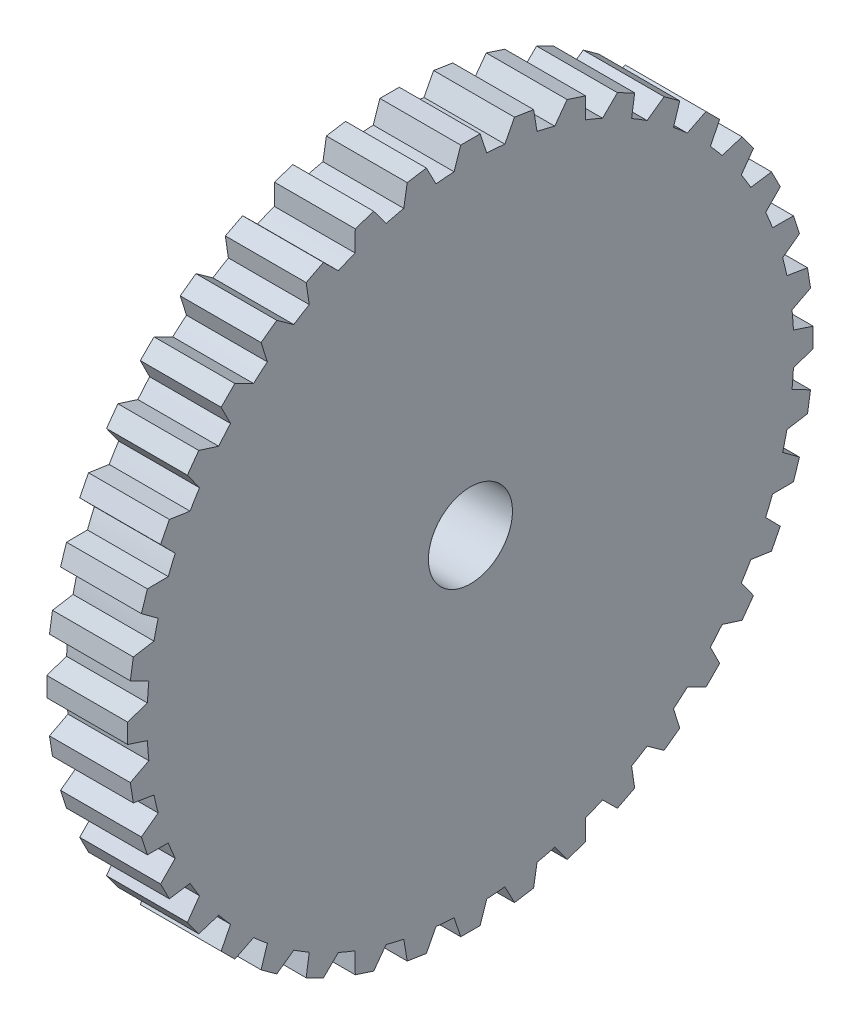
SolidWorks part; units mm, degrees
ref_plane "Front Plane" through (0, 0, 0) normal (0, 0, 1) x (1, 0, 0)
ref_plane "Top Plane" through (0, 0, 0) normal (0, 1, 0) x (1, 0, 0)
ref_plane "Right Plane" through (0, 0, 0) normal (1, 0, 0) x (0, 0, -1)
sketch "Sketch1" plane through (0, 0, 0) normal (1, 0, 0) x (0, 0, -1)
  circle A0 centre (0, 0) radius 12.7
extrude "Boss-Extrude1" add sketch "Sketch1" along normal blind 3.175
sketch "Sketch2" plane through (3.175, 0, 0) normal (1, 0, 0) x (0, 0, -1)
  line L0 (1.7296, 13.3559) -> (2.4822, 13.2367)
  line L1 (-0.762, 12.319) -> (0.762, 12.319)
  line L2 (1.7296, 13.3559) -> (1.1745, 12.2865)
  line L3 (-0.381, 13.462) -> (0.381, 13.462)
  line L4 (0.381, 13.462) -> (0.762, 12.319)
  line L5 (-0.381, 13.462) -> (-0.762, 12.319)
  line L6 (1.1745, 12.2865) -> (2.6797, 12.0481)
  line L7 (2.4822, 13.2367) -> (2.6797, 12.0481)
  line L8 (3.7976, 12.9209) -> (4.5223, 12.6854)
  line L9 (3.7976, 12.9209) -> (3.0821, 11.9515)
  line L10 (3.0821, 11.9515) -> (4.5315, 11.4806)
  line L11 (4.5223, 12.6854) -> (4.5315, 11.4806)
  line L12 (5.7721, 12.1677) -> (6.4511, 11.8218)
  line L13 (5.7721, 12.1677) -> (4.9138, 11.3223)
  line L14 (4.9138, 11.3223) -> (6.2717, 10.6304)
  line L15 (6.4511, 11.8218) -> (6.2717, 10.6304)
  line L16 (7.6045, 11.1149) -> (8.221, 10.667)
  line L17 (7.6045, 11.1149) -> (6.6245, 10.4142)
  line L18 (6.6245, 10.4142) -> (7.8574, 9.5184)
  line L19 (8.221, 10.667) -> (7.8574, 9.5184)
  line L20 (9.2497, 9.7885) -> (9.7885, 9.2497)
  line L21 (9.2497, 9.7885) -> (8.172, 9.2497)
  line L22 (8.172, 9.2497) -> (9.2497, 8.172)
  line L23 (9.7885, 9.2497) -> (9.2497, 8.172)
  line L24 (10.667, 8.221) -> (11.1149, 7.6045)
  line L25 (10.667, 8.221) -> (9.5184, 7.8574)
  line L26 (9.5184, 7.8574) -> (10.4142, 6.6245)
  line L27 (11.1149, 7.6045) -> (10.4142, 6.6245)
  line L28 (11.8218, 6.4511) -> (12.1677, 5.7721)
  line L29 (11.8218, 6.4511) -> (10.6304, 6.2717)
  line L30 (10.6304, 6.2717) -> (11.3223, 4.9138)
  line L31 (12.1677, 5.7721) -> (11.3223, 4.9138)
  line L32 (12.6854, 4.5223) -> (12.9209, 3.7976)
  line L33 (12.6854, 4.5223) -> (11.4806, 4.5315)
  line L34 (11.4806, 4.5315) -> (11.9515, 3.0821)
  line L35 (12.9209, 3.7976) -> (11.9515, 3.0821)
  line L36 (13.2367, 2.4822) -> (13.3559, 1.7296)
  line L37 (13.2367, 2.4822) -> (12.0481, 2.6797)
  line L38 (12.0481, 2.6797) -> (12.2865, 1.1745)
  line L39 (13.3559, 1.7296) -> (12.2865, 1.1745)
  line L40 (13.462, 0.381) -> (13.462, -0.381)
  line L41 (13.462, 0.381) -> (12.319, 0.762)
  line L42 (12.319, 0.762) -> (12.319, -0.762)
  line L43 (13.462, -0.381) -> (12.319, -0.762)
  line L44 (13.3559, -1.7296) -> (13.2367, -2.4822)
  line L45 (13.3559, -1.7296) -> (12.2865, -1.1745)
  line L46 (12.2865, -1.1745) -> (12.0481, -2.6797)
  line L47 (13.2367, -2.4822) -> (12.0481, -2.6797)
  line L48 (12.9209, -3.7976) -> (12.6854, -4.5223)
  line L49 (12.9209, -3.7976) -> (11.9515, -3.0821)
  line L50 (11.9515, -3.0821) -> (11.4806, -4.5315)
  line L51 (12.6854, -4.5223) -> (11.4806, -4.5315)
  line L52 (12.1677, -5.7721) -> (11.8218, -6.4511)
  line L53 (12.1677, -5.7721) -> (11.3223, -4.9138)
  line L54 (11.3223, -4.9138) -> (10.6304, -6.2717)
  line L55 (11.8218, -6.4511) -> (10.6304, -6.2717)
  line L56 (11.1149, -7.6045) -> (10.667, -8.221)
  line L57 (11.1149, -7.6045) -> (10.4142, -6.6245)
  line L58 (10.4142, -6.6245) -> (9.5184, -7.8574)
  line L59 (10.667, -8.221) -> (9.5184, -7.8574)
  line L60 (9.7885, -9.2497) -> (9.2497, -9.7885)
  line L61 (9.7885, -9.2497) -> (9.2497, -8.172)
  line L62 (9.2497, -8.172) -> (8.172, -9.2497)
  line L63 (9.2497, -9.7885) -> (8.172, -9.2497)
  line L64 (8.221, -10.667) -> (7.6045, -11.1149)
  line L65 (8.221, -10.667) -> (7.8574, -9.5184)
  line L66 (7.8574, -9.5184) -> (6.6245, -10.4142)
  line L67 (7.6045, -11.1149) -> (6.6245, -10.4142)
  line L68 (6.4511, -11.8218) -> (5.7721, -12.1677)
  line L69 (6.4511, -11.8218) -> (6.2717, -10.6304)
  line L70 (6.2717, -10.6304) -> (4.9138, -11.3223)
  line L71 (5.7721, -12.1677) -> (4.9138, -11.3223)
  line L72 (4.5223, -12.6854) -> (3.7976, -12.9209)
  line L73 (4.5223, -12.6854) -> (4.5315, -11.4806)
  line L74 (4.5315, -11.4806) -> (3.0821, -11.9515)
  line L75 (3.7976, -12.9209) -> (3.0821, -11.9515)
  line L76 (2.4822, -13.2367) -> (1.7296, -13.3559)
  line L77 (2.4822, -13.2367) -> (2.6797, -12.0481)
  line L78 (2.6797, -12.0481) -> (1.1745, -12.2865)
  line L79 (1.7296, -13.3559) -> (1.1745, -12.2865)
  line L80 (0.381, -13.462) -> (-0.381, -13.462)
  line L81 (0.381, -13.462) -> (0.762, -12.319)
  line L82 (0.762, -12.319) -> (-0.762, -12.319)
  line L83 (-0.381, -13.462) -> (-0.762, -12.319)
  line L84 (-1.7296, -13.3559) -> (-2.4822, -13.2367)
  line L85 (-1.7296, -13.3559) -> (-1.1745, -12.2865)
  line L86 (-1.1745, -12.2865) -> (-2.6797, -12.0481)
  line L87 (-2.4822, -13.2367) -> (-2.6797, -12.0481)
  line L88 (-3.7976, -12.9209) -> (-4.5223, -12.6854)
  line L89 (-3.7976, -12.9209) -> (-3.0821, -11.9515)
  line L90 (-3.0821, -11.9515) -> (-4.5315, -11.4806)
  line L91 (-4.5223, -12.6854) -> (-4.5315, -11.4806)
  line L92 (-5.7721, -12.1677) -> (-6.4511, -11.8218)
  line L93 (-5.7721, -12.1677) -> (-4.9138, -11.3223)
  line L94 (-4.9138, -11.3223) -> (-6.2717, -10.6304)
  line L95 (-6.4511, -11.8218) -> (-6.2717, -10.6304)
  line L96 (-7.6045, -11.1149) -> (-8.221, -10.667)
  line L97 (-7.6045, -11.1149) -> (-6.6245, -10.4142)
  line L98 (-6.6245, -10.4142) -> (-7.8574, -9.5184)
  line L99 (-8.221, -10.667) -> (-7.8574, -9.5184)
  line L100 (-9.2497, -9.7885) -> (-9.7885, -9.2497)
  line L101 (-9.2497, -9.7885) -> (-8.172, -9.2497)
  line L102 (-8.172, -9.2497) -> (-9.2497, -8.172)
  line L103 (-9.7885, -9.2497) -> (-9.2497, -8.172)
  line L104 (-10.667, -8.221) -> (-11.1149, -7.6045)
  line L105 (-10.667, -8.221) -> (-9.5184, -7.8574)
  line L106 (-9.5184, -7.8574) -> (-10.4142, -6.6245)
  line L107 (-11.1149, -7.6045) -> (-10.4142, -6.6245)
  line L108 (-11.8218, -6.4511) -> (-12.1677, -5.7721)
  line L109 (-11.8218, -6.4511) -> (-10.6304, -6.2717)
  line L110 (-10.6304, -6.2717) -> (-11.3223, -4.9138)
  line L111 (-12.1677, -5.7721) -> (-11.3223, -4.9138)
  line L112 (-12.6854, -4.5223) -> (-12.9209, -3.7976)
  line L113 (-12.6854, -4.5223) -> (-11.4806, -4.5315)
  line L114 (-11.4806, -4.5315) -> (-11.9515, -3.0821)
  line L115 (-12.9209, -3.7976) -> (-11.9515, -3.0821)
  line L116 (-13.2367, -2.4822) -> (-13.3559, -1.7296)
  line L117 (-13.2367, -2.4822) -> (-12.0481, -2.6797)
  line L118 (-12.0481, -2.6797) -> (-12.2865, -1.1745)
  line L119 (-13.3559, -1.7296) -> (-12.2865, -1.1745)
  line L120 (-13.462, -0.381) -> (-13.462, 0.381)
  line L121 (-13.462, -0.381) -> (-12.319, -0.762)
  line L122 (-12.319, -0.762) -> (-12.319, 0.762)
  line L123 (-13.462, 0.381) -> (-12.319, 0.762)
  line L124 (-13.3559, 1.7296) -> (-13.2367, 2.4822)
  line L125 (-13.3559, 1.7296) -> (-12.2865, 1.1745)
  line L126 (-12.2865, 1.1745) -> (-12.0481, 2.6797)
  line L127 (-13.2367, 2.4822) -> (-12.0481, 2.6797)
  line L128 (-12.9209, 3.7976) -> (-12.6854, 4.5223)
  line L129 (-12.9209, 3.7976) -> (-11.9515, 3.0821)
  line L130 (-11.9515, 3.0821) -> (-11.4806, 4.5315)
  line L131 (-12.6854, 4.5223) -> (-11.4806, 4.5315)
  line L132 (-12.1677, 5.7721) -> (-11.8218, 6.4511)
  line L133 (-12.1677, 5.7721) -> (-11.3223, 4.9138)
  line L134 (-11.3223, 4.9138) -> (-10.6304, 6.2717)
  line L135 (-11.8218, 6.4511) -> (-10.6304, 6.2717)
  line L136 (-11.1149, 7.6045) -> (-10.667, 8.221)
  line L137 (-11.1149, 7.6045) -> (-10.4142, 6.6245)
  line L138 (-10.4142, 6.6245) -> (-9.5184, 7.8574)
  line L139 (-10.667, 8.221) -> (-9.5184, 7.8574)
  line L140 (-9.7885, 9.2497) -> (-9.2497, 9.7885)
  line L141 (-9.7885, 9.2497) -> (-9.2497, 8.172)
  line L142 (-9.2497, 8.172) -> (-8.172, 9.2497)
  line L143 (-9.2497, 9.7885) -> (-8.172, 9.2497)
  line L144 (-8.221, 10.667) -> (-7.6045, 11.1149)
  line L145 (-8.221, 10.667) -> (-7.8574, 9.5184)
  line L146 (-7.8574, 9.5184) -> (-6.6245, 10.4142)
  line L147 (-7.6045, 11.1149) -> (-6.6245, 10.4142)
  line L148 (-6.4511, 11.8218) -> (-5.7721, 12.1677)
  line L149 (-6.4511, 11.8218) -> (-6.2717, 10.6304)
  line L150 (-6.2717, 10.6304) -> (-4.9138, 11.3223)
  line L151 (-5.7721, 12.1677) -> (-4.9138, 11.3223)
  line L152 (-4.5223, 12.6854) -> (-3.7976, 12.9209)
  line L153 (-4.5223, 12.6854) -> (-4.5315, 11.4806)
  line L154 (-4.5315, 11.4806) -> (-3.0821, 11.9515)
  line L155 (-3.7976, 12.9209) -> (-3.0821, 11.9515)
  line L156 (-2.4822, 13.2367) -> (-1.7296, 13.3559)
  line L157 (-2.4822, 13.2367) -> (-2.6797, 12.0481)
  line L158 (-2.6797, 12.0481) -> (-1.1745, 12.2865)
  line L159 (-1.7296, 13.3559) -> (-1.1745, 12.2865)
extrude "Boss-Extrude2" add sketch "Sketch2" against normal blind 3.175
sketch "Sketch3" plane through (3.175, 0, 0) normal (1, 0, 0) x (0, 0, -1)
  circle A0 centre (0, 0) radius 1.651
extrude "Cut-Extrude1" cut sketch "Sketch3" against normal blind 3.175
